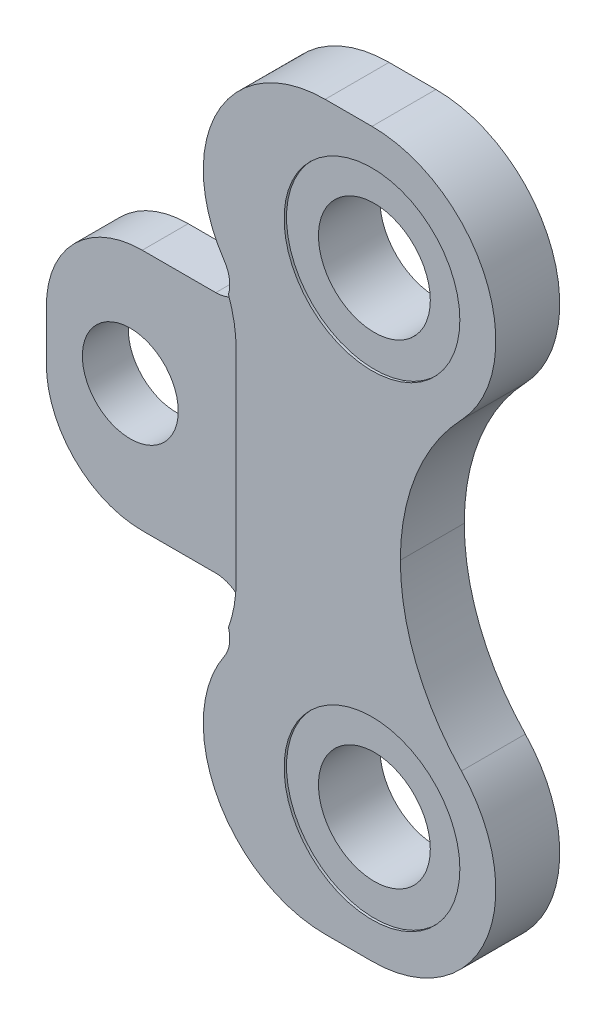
SolidWorks part; units mm, degrees
ref_plane "Plan de face" through (0, 0, 0) normal (0, 0, 1) x (1, 0, 0)
ref_plane "Plan de dessus" through (0, 0, 0) normal (0, 1, 0) x (1, 0, 0)
ref_plane "Plan de droite" through (0, 0, 0) normal (1, 0, 0) x (0, 0, -1)
sketch "Esquisse1" plane through (0, 0, 0) normal (0, 0, 1) x (1, 0, 0)
  line L0 (-10.5, 0) -> (-6, 0)
  line L1 (-10.5, 0) -> (-10.5, 3)
  line L2 (6, 0) -> (36.05, 0)
  line L3 (1.5, 15.2017) -> (10.7, 15.2017)
  line L4 (32.5, 45.25) -> (26.6361, 45.25)
  arc A0 (6, 0) -> (-6, 0) centre (0, 0) ccw
  arc A1 (-10.5, 3) -> (1.5, 15.2017) centre (1.5, 3.2) cw
  arc A2 (10.7, 15.2017) -> (14.0114, 21.4455) centre (10.7, 19.2017) ccw
  circle A3 centre (32.5, 29.75) radius 7
  arc A4 (43.6924, 19.0272) -> (36.05, 0) centre (63.55, 0.0028) ccw
  arc A5 (26.6361, 45.25) -> (14.0114, 21.4455) centre (26.6361, 30) ccw
  arc A6 (32.5, 45.25) -> (43.6924, 19.0272) centre (32.5, 29.75) cw
  point P1 (1.5, 3.2)
  dimension "D1" = 12
  dimension "D6" = 9.2
  dimension "D7" = 4
  dimension "D8" = 14
  dimension "D9" = 29.75
  dimension "D10" = 43
  dimension "D11" = 55
  dimension "D12" = 74.05
  dimension "D13" = 45.25
  dimension "D14" = 15.5
  dimension "D15" = 15.25
  dimension "D2" = 10.5
  dimension "D3" = 3
  dimension "D4" = 3.2
  dimension "D5" = 12
extrude "Extrusion1" add sketch "Esquisse1" along normal blind 8
sketch "Esquisse2" plane through (0, 0, 8) normal (0, 0, 1) x (1, 0, 0)
  circle A0 centre (32.5, 29.75) radius 11
  dimension "D1" = 22
extrude "Extrusion2" cut sketch "Esquisse2" against normal blind 0.3
sketch "Esquisse3" plane through (0, 0, 8) normal (0, 0, 1) x (1, 0, 0)
  line L0 (15.5, 12.5) -> (15.5, 0)
  line L1 (6, 0) -> (36.05, 0) construction
  line L2 (-10.5, 3) -> (-10.5, 0) construction
  line L3 (1.7742, 28.7651) -> (-15.9153, 28.7651)
  line L4 (-15.9153, 28.7651) -> (-15.9153, 0)
  line L5 (-15.9153, 0) -> (15.5, 0)
  arc A0 (15.5, 12.5) -> (1.7742, 28.7651) centre (-1, 12.5) ccw
  dimension "D3" = 16.5
  dimension "D1" = 12.5
  dimension "D2" = 26
extrude "Extrusion3" cut sketch "Esquisse3" against normal blind 2.25
mirror "Symétrie1" about plane through (6, 0, 8) normal (0, 1, 0) of "Extrusion3", "Extrusion2", "Extrusion1"
